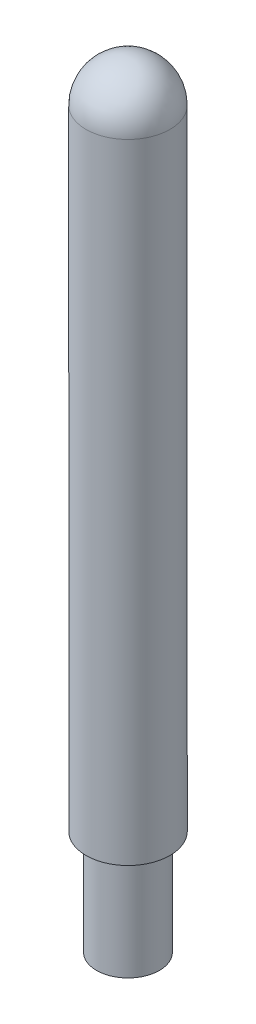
SolidWorks part; units mm, degrees
ref_plane "Front Plane" through (0, 0, 0) normal (0, 0, 1) x (1, 0, 0)
ref_plane "Top Plane" through (0, 0, 0) normal (0, 1, 0) x (1, 0, 0)
ref_plane "Right Plane" through (0, 0, 0) normal (1, 0, 0) x (0, 0, -1)
sketch "Sketch1" plane through (0, 0, 0) normal (0, 1, 0) x (1, 0, 0)
  circle A0 centre (0, 0) radius 3
  dimension "D1" = 6
extrude "Extrude1" add sketch "Sketch1" along normal blind 10
sketch "Sketch2" plane through (0, 10, 0) normal (0, 1, 0) x (1, 0, 0)
  circle A0 centre (0, 0) radius 4
  dimension "D1" = 8
extrude "Extrude2" add sketch "Sketch2" along normal blind 60
sketch "Sketch3" plane through (0, 0, 0) normal (0, 0, 1) x (1, 0, 0)
  line L0 (4, 70) -> (-4, 70) construction
  line L1 (0, 74) -> (0, 70)
  line L2 (0, 70) -> (4, 70)
  arc A0 (4, 70) -> (0, 74) centre (0, 70) ccw
revolve "Revolve1" add sketch "Sketch3" angle 360 about L1
